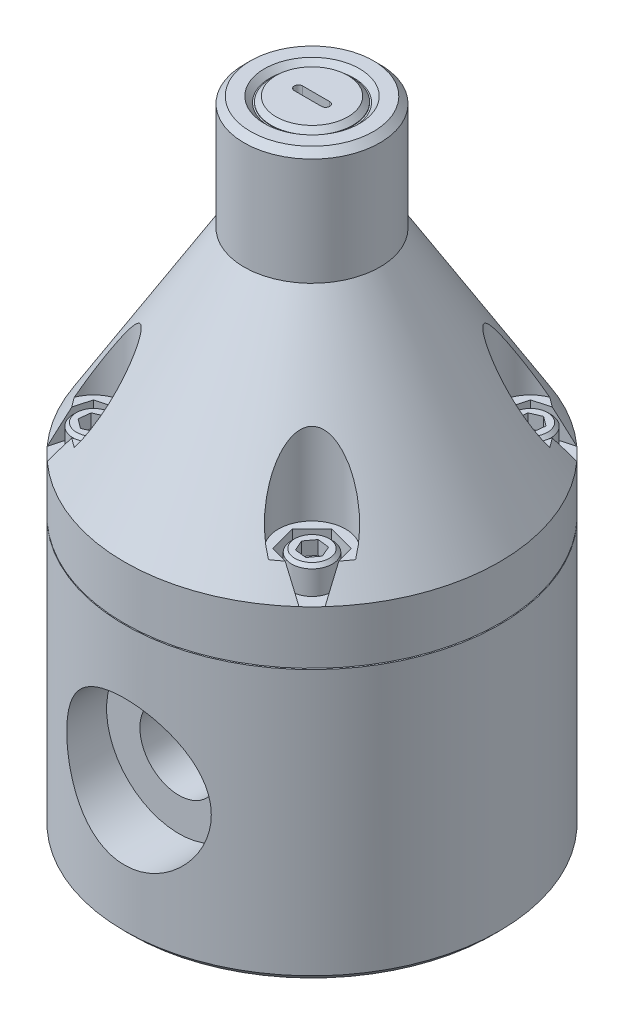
SolidWorks part; units mm, degrees
ref_plane "Front Plane" through (0, 0, 0) normal (0, 0, 1) x (1, 0, 0)
ref_plane "Top Plane" through (0, 0, 0) normal (0, 1, 0) x (1, 0, 0)
ref_plane "Right Plane" through (0, 0, 0) normal (1, 0, 0) x (0, 0, -1)
sketch "Sketch1" plane through (0, 0, 0) normal (0, 1, 0) x (1, 0, 0)
  circle A0 centre (0, 0) radius 43.815
  dimension "D1" = 87.63
extrude "Extrude1" add sketch "Sketch1" along normal blind 148.59
sketch "Sketch2" plane through (0, 0, 0) normal (0, 0, 1) x (1, 0, 0)
  line L0 (0, 148.59) -> (0, 0) construction
  line L1 (43.815, 148.59) -> (-43.815, 148.59) construction
  line L2 (-52.6288, 63.5) -> (-30.226, 63.5)
  line L4 (-30.226, 63.5) -> (-30.226, 63.754)
  line L5 (-30.226, 63.754) -> (-43.815, 63.754)
  line L7 (-43.815, 63.754) -> (-43.815, 76.2)
  line L8 (-43.815, 76.2) -> (-15.875, 121.92)
  line L9 (-15.875, 121.92) -> (-15.875, 152.4)
  line L10 (-15.875, 152.4) -> (-52.6288, 152.4)
  line L11 (-52.6288, 152.4) -> (-52.6288, 63.5)
  line L12 (-43.815, 0) -> (43.815, 0) construction
  dimension "D1" = 43.815
  dimension "D2" = 15.875
  dimension "D3" = 63.5
  dimension "D4" = 30.226
  dimension "D5" = 0.254
  dimension "D6" = 76.2
  dimension "D7" = 152.4
  dimension "D8" = 121.92
revolve "Cut-Revolve1" cut sketch "Sketch2" angle 360 about L0
chamfer "Chamfer1" distance 1.524 angle 45 2 edges at (0, 0, 43.815) (0, 148.59, 15.875)
ref_plane "Plane1" through (0, 148.59, 0) normal (0, 1, 0) x (-1, 0, 0)
sketch "Sketch3" plane through (0, 148.59, 0) normal (0, 1, 0) x (-1, 0, 0)
  circle A0 centre (0, 0) radius 11.1125
  dimension "D1" = 22.225
extrude "Extrude2" cut sketch "Sketch3" against normal blind 1.27 draft 45
sketch "Sketch4" plane through (0, 148.59, 0) normal (0, 1, 0) x (-1, 0, 0)
  circle A0 centre (0, 0) radius 9.525
  dimension "D1" = 19.05
extrude "Extrude3" add sketch "Sketch4" against normal up to surface (1.27 mm away)
chamfer "Chamfer2" distance 1.143 angle 45 1 edges at (0, 148.59, 9.525)
sketch "Sketch5" plane through (0, 148.59, 0) normal (0, 1, 0) x (-1, 0, 0)
  line L0 (3.175, 0) -> (-3.175, 0) construction
  line L1 (3.175, 0.9652) -> (-3.175, 0.9652)
  line L2 (-3.175, -0.9652) -> (3.175, -0.9652)
  arc A0 (-3.175, 0.9652) -> (-3.175, -0.9652) centre (-3.175, 0) ccw
  arc A1 (3.175, -0.9652) -> (3.175, 0.9652) centre (3.175, 0) ccw
  dimension "D1" = 3.175
  dimension "D2" = 6.35
  dimension "D3" = 0.9652
  dimension "D4" = 0.9652
extrude "Extrude4" cut sketch "Sketch5" against normal blind 3.175 draft 1
ref_plane "Plane2" through (0, 82.55, 0) normal (0, 1, 0) x (-1, 0, 0)
sketch "Sketch6" plane through (0, 82.55, 0) normal (0, 1, 0) x (-1, 0, 0)
  line L0 (0, 0) -> (-30.9819, 30.9819) construction
  circle A0 centre (0, 0) radius 36.0934 construction
  circle A1 centre (0, 0) radius 43.815 construction
  circle A2 centre (-25.5219, 25.5219) radius 7.874
  dimension "D1" = 15.748
extrude "Extrude5" cut sketch "Sketch6" along normal blind 22.86
sketch "Sketch7" plane through (0, 82.55, 0) normal (0, 1, 0) x (-1, 0, 0)
  line L0 (0, 0) -> (-25.5219, 25.5219) construction
  line L1 (-25.5219, 25.5219) -> (-31.0896, 19.9541) construction
  line L2 (-25.5219, 25.5219) -> (-19.9541, 31.0896) construction
  line L3 (-25.5219, 25.5219) -> (-39.3911, 39.3911) construction
  line L4 (-30.0845, 20.9593) -> (-23.8519, 19.2893)
  line L5 (-23.8519, 19.2893) -> (-19.2893, 23.8519)
  line L6 (-19.2893, 23.8519) -> (-20.9593, 30.0845)
  line L10 (-30.0845, 20.9593) -> (-33.6536, 33.6536)
  line L11 (-33.6536, 33.6536) -> (-20.9593, 30.0845)
  line L13 (-27.1919, 31.7545) -> (-31.7545, 27.1919)
  line L14 (-20.9593, 30.0845) -> (-27.1919, 31.7545)
  line L15 (-31.7545, 27.1919) -> (-30.0845, 20.9593)
  arc A0 (-32.8666, 22.6837) -> (-22.6837, 32.8666) centre (-25.5219, 25.5219) ccw construction
  circle A1 centre (-25.5219, 25.5219) radius 5.588 construction
extrude "Extrude6" cut sketch "Sketch7" against normal blind 6.35
sketch "Sketch8" plane through (0, 82.55, 0) normal (0, 1, 0) x (-1, 0, 0)
  circle A0 centre (-25.5219, 25.5219) radius 4.7625
  dimension "D1" = 9.525
extrude "Extrude7" add sketch "Sketch8" against normal up to surface (6.35 mm away)
sketch "Sketch9" plane through (0, 82.55, 0) normal (0, 1, 0) x (-1, 0, 0)
  line L1 (-23.8739, 27.7452) -> (-26.6233, 28.0608)
  line L2 (-26.6233, 28.0608) -> (-28.2713, 25.8375)
  line L3 (-28.2713, 25.8375) -> (-27.1699, 23.2986)
  line L4 (-27.1699, 23.2986) -> (-24.4205, 22.983)
  line L5 (-24.4205, 22.983) -> (-22.7725, 25.2063)
  line L6 (-22.7725, 25.2063) -> (-23.8739, 27.7452)
  circle A0 centre (-25.5219, 25.5219) radius 2.3967 construction
extrude "Extrude8" cut sketch "Sketch9" against normal blind 3.175
pattern_circular "CirPattern1" count 4 over 360 about axis through (0, 0, 0) along (0, 1, 0) of "Extrude5", "Extrude6", "Extrude7", "Extrude8"
chamfer "Chamfer3" distance 0.762 angle 45 4 edges at (25.5219, 82.55, 30.2844) (30.2844, 82.55, -25.5219) (-25.5219, 82.55, -30.2844) (-30.2844, 82.55, 25.5219)
ref_plane "Plane3" through (0, 0, 43.815) normal (0, 0, 1) x (1, 0, 0)
hole_wizard "CBORE for #00 Binding Head Machine Screw1" positions "3DSketch1" profile "Sketch12" counterbore size "#00" standard "Ansi Inch"
sketch3d "3DSketch1"
  point P0 (0, 31.75, 43.815)
sketch "Sketch12" plane through (0, 31.75, 43.815) normal (1, 0, 0) x (0, -1, 0)
  line L0 (0, 0) -> (0, 29.9464)
  line L1 (0, 29.9464) -> (9.1186, 25.4)
  line L2 (9.1186, 25.4) -> (9.1186, 12.7)
  line L3 (9.1186, 12.7) -> (16.891, 12.7)
  line L4 (16.891, 12.7) -> (16.891, 0)
  line L5 (16.891, 0) -> (0, 0)
  line L10 (0, 29.9464) -> (-9.1186, 25.4) construction
  line L11 (0, -6.35) -> (0, 107.95) construction
  dimension "Hole Dia." = 18.2372
  dimension "Hole Depth" = 25.4
  dimension "C'Bore Dia." = 33.782
  dimension "C'Bore Depth" = 12.7
  dimension "Drill Angle" = 127
mirror "Mirror1" about plane through (0, 0, 0) normal (0, 0, 1) of "CBORE for #00 Binding Head Machine Screw1"
